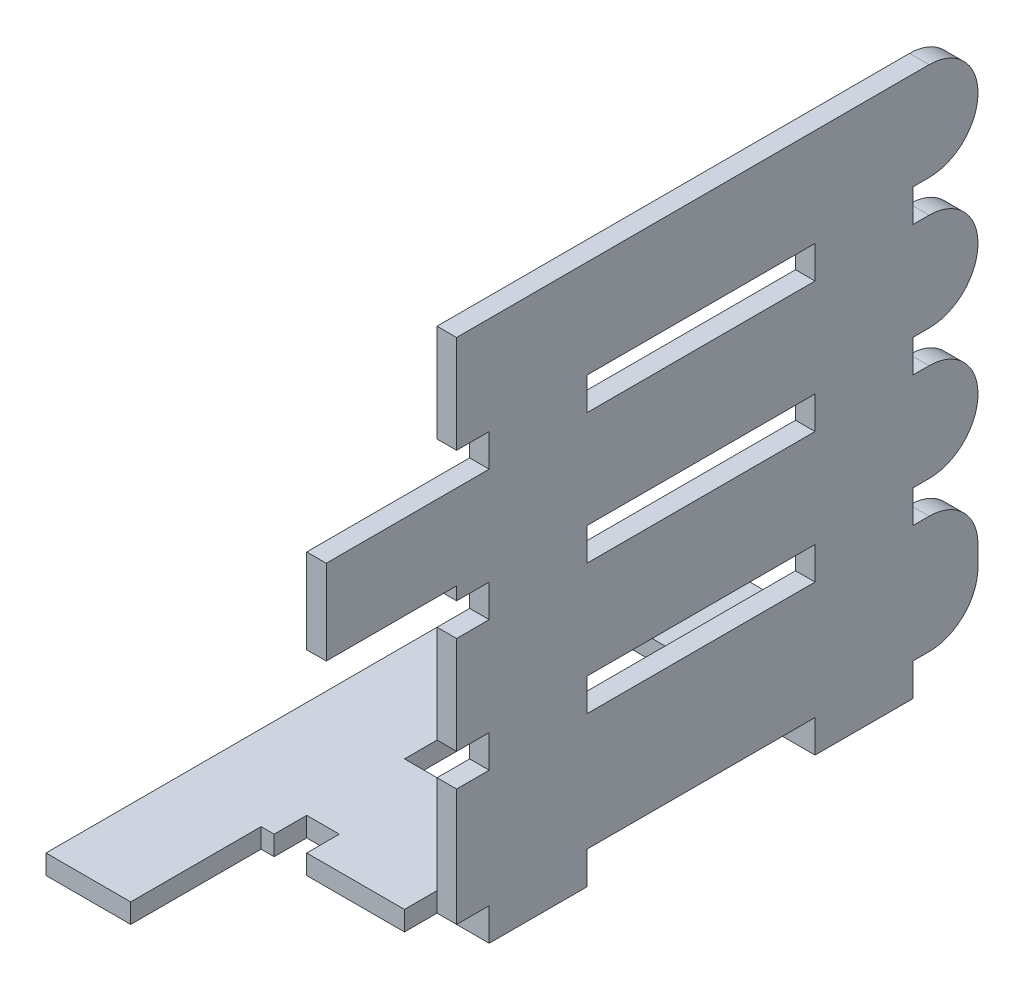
SolidWorks part; units mm, degrees
ref_plane "Plan de face" through (0, 0, 0) normal (0, 0, 1) x (1, 0, 0)
ref_plane "Plan de dessus" through (0, 0, 0) normal (0, 1, 0) x (1, 0, 0)
ref_plane "Plan de droite" through (0, 0, 0) normal (1, 0, 0) x (0, 0, -1)
sketch "Esquisse1" plane through (0, 0, 0) normal (0, 0, 1) x (1, 0, 0)
  line L0 (0, 0) -> (40, 0)
  line L1 (40, 0) -> (40, 80)
extrude "Extru.-Mince1" add sketch "Esquisse1" along normal blind 100 thin
sketch "Esquisse2" plane through (43, 0, 0) normal (1, 0, 0) x (0, 0, -1)
  line L1 (-100, 80) -> (-80, 80)
  line L2 (-100, 80) -> (-100, 60)
  line L3 (-100, 60) -> (-80, 60)
  line L4 (-80, 80) -> (-80, 60)
  line L5 (-100, -3) -> (-80, -3)
  line L6 (-100, -3) -> (-100, 47)
  line L7 (-100, 47) -> (-80, 47)
  line L8 (-80, -3) -> (-80, 47)
extrude "Extrusion1" cut sketch "Esquisse2" against normal blind 3
sketch "Esquisse3" plane through (0, -3, 0) normal (0, -1, 0) x (1, 0, 0)
  line L0 (0, 100) -> (40, 100) construction
  line L1 (13, 100) -> (43, 100)
  line L2 (13, 100) -> (13, 80)
  line L3 (13, 80) -> (43, 80)
  line L4 (43, 100) -> (43, 80)
extrude "Extrusion2" cut sketch "Esquisse3" against normal blind 3
sketch "Esquisse4" plane through (43, 0, 0) normal (1, 0, 0) x (0, 0, -1)
  line L0 (-80, 60) -> (-80, 80) construction
  line L1 (-80, 65) -> (-75, 65)
  line L2 (-80, 65) -> (-80, 60)
  line L3 (-80, 60) -> (-75, 60)
  line L4 (-75, 65) -> (-75, 60)
  line L5 (-80, -3) -> (-80, 47) construction
  line L6 (-80, 45) -> (-75, 45)
  line L7 (-80, 45) -> (-80, 40)
  line L8 (-80, 40) -> (-75, 40)
  line L9 (-75, 45) -> (-75, 40)
  line L10 (0, -3) -> (0, 80) construction
  line L11 (-80, 25) -> (-75, 25)
  line L12 (-80, 25) -> (-80, 20)
  line L13 (-80, 20) -> (-75, 20)
  line L14 (-75, 25) -> (-75, 20)
  line L15 (-60, 65) -> (-25, 65)
  line L16 (-60, 65) -> (-60, 60)
  line L17 (-60, 60) -> (-25, 60)
  line L18 (-25, 65) -> (-25, 60)
  line L19 (-10, 65) -> (0, 65)
  line L20 (-10, 65) -> (-10, 60)
  line L21 (-10, 60) -> (0, 60)
  line L22 (0, 65) -> (0, 60)
  line L23 (-80, -3) -> (0, -3) construction
  line L24 (-60, 40) -> (-25, 40)
  line L25 (-60, 40) -> (-60, 45)
  line L26 (-60, 45) -> (-25, 45)
  line L27 (-25, 40) -> (-25, 45)
  line L28 (-10, 45) -> (0, 45)
  line L29 (-10, 45) -> (-10, 40)
  line L30 (-10, 40) -> (0, 40)
  line L31 (0, 45) -> (0, 40)
  line L32 (-60, 25) -> (-25, 25)
  line L33 (-60, 25) -> (-60, 20)
  line L34 (-60, 20) -> (-25, 20)
  line L35 (-25, 25) -> (-25, 20)
  line L36 (-10, 25) -> (0, 25)
  line L37 (-10, 25) -> (-10, 20)
  line L38 (-10, 20) -> (0, 20)
  line L39 (0, 25) -> (0, 20)
  line L40 (-80, 2) -> (-75, 2)
  line L41 (-80, 2) -> (-80, -3)
  line L42 (-80, -3) -> (-75, -3)
  line L43 (-75, 2) -> (-75, -3)
  line L45 (-60, 2) -> (-25, 2)
  line L46 (-60, 2) -> (-60, -3)
  line L47 (-60, -3) -> (-25, -3)
  line L48 (-25, 2) -> (-25, -3)
  line L49 (-10, 2) -> (0, 2)
  line L50 (-10, 2) -> (-10, -3)
  line L51 (-10, -3) -> (0, -3)
  line L52 (0, 2) -> (0, -3)
extrude "Extrusion3" cut sketch "Esquisse4" against normal blind 3
fillet "Congé1" radius 7.5 8 edges at (41.5, 2, 0) (41.5, 20, 0) (41.5, 25, 0) (41.5, 40, 0) (41.5, 45, 0) (41.5, 60, 0) (41.5, 65, 0) (41.5, 80, 0)
sketch "Esquisse5" plane through (0, -3, 0) normal (0, -1, 0) x (1, 0, 0)
  line L0 (0, 0) -> (40, 0) construction
  line L1 (40, 80) -> (35, 80)
  line L2 (40, 80) -> (40, 75)
  line L3 (40, 75) -> (35, 75)
  line L4 (35, 80) -> (35, 75)
  line L5 (40, 60) -> (35, 60)
  line L6 (40, 60) -> (40, 25)
  line L7 (40, 25) -> (35, 25)
  line L8 (35, 60) -> (35, 25)
  line L9 (40, 10) -> (35, 10)
  line L10 (40, 10) -> (40, 0)
  line L11 (40, 0) -> (35, 0)
  line L12 (35, 10) -> (35, 0)
  line L13 (13, 80) -> (40, 80) construction
  line L14 (20, 80) -> (15, 80)
  line L15 (20, 80) -> (20, 75)
  line L16 (20, 75) -> (15, 75)
  line L17 (15, 80) -> (15, 75)
  line L19 (20, 60) -> (15, 60)
  line L20 (20, 60) -> (20, 25)
  line L21 (20, 25) -> (15, 25)
  line L22 (15, 60) -> (15, 25)
  line L23 (20, 10) -> (15, 10)
  line L24 (20, 10) -> (20, 0)
  line L25 (20, 0) -> (15, 0)
  line L26 (15, 10) -> (15, 0)
extrude "Extrusion4" cut sketch "Esquisse5" against normal blind 3
fillet "Congé2" radius 7.5 4 edges at (0, -1.5, 0) (15, -1.5, 0) (20, -1.5, 0) (35, -1.5, 0)
